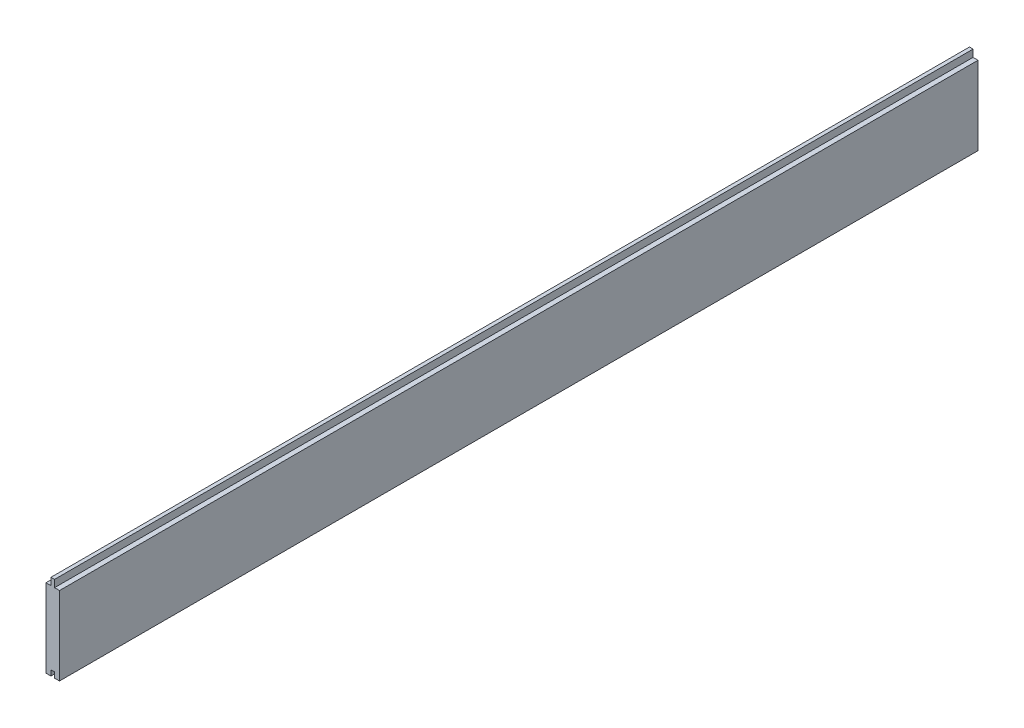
SolidWorks part; units mm, degrees
ref_plane "Plan de face" through (0, 0, 0) normal (0, 0, 1) x (1, 0, 0)
ref_plane "Plan de dessus" through (0, 0, 0) normal (0, 1, 0) x (1, 0, 0)
ref_plane "Plan de droite" through (0, 0, 0) normal (1, 0, 0) x (0, 0, -1)
sketch "Esquisse1" plane through (0, 0, 0) normal (0, 0, 1) x (1, 0, 0)
  line L1 (-7.5, 43.5) -> (7.5, 43.5)
  line L2 (-7.5, 43.5) -> (-7.5, -43.5)
  line L3 (-7.5, -43.5) -> (7.5, -43.5)
  line L4 (7.5, 43.5) -> (7.5, -43.5)
  line L5 (-7.5, 43.5) -> (7.5, -43.5) construction
  line L6 (-7.5, -43.5) -> (7.5, 43.5) construction
  line L7 (-2, 51.5) -> (2, 51.5)
  line L8 (-2, 51.5) -> (-2, 35.5)
  line L9 (-2, 35.5) -> (2, 35.5)
  line L10 (2, 51.5) -> (2, 35.5)
  line L11 (-2, 51.5) -> (2, 35.5) construction
  line L12 (-2, 35.5) -> (2, 51.5) construction
  line L13 (-2, -37.5) -> (2, -37.5)
  line L14 (-2, -37.5) -> (-2, -49.5)
  line L15 (-2, -49.5) -> (2, -49.5)
  line L16 (2, -37.5) -> (2, -49.5)
  line L17 (-2, -37.5) -> (2, -49.5) construction
  line L18 (-2, -49.5) -> (2, -37.5) construction
  point P0 (0, 0)
  point P5 (0, 43.5)
  point P11 (0, -43.5)
  dimension "D1" = 87
  dimension "D2" = 15
  dimension "D3" = 4
  dimension "D4" = 16
  dimension "D5" = 4
  dimension "D6" = 12
extrude "Boss.-Extru.1" add sketch "Esquisse1" along normal blind 1020 contours L10 L7 L8 L1 | L10 L1 L8 L9 | L13 L16 L3 L4 L1 L10 L9 L8 L2 L14
